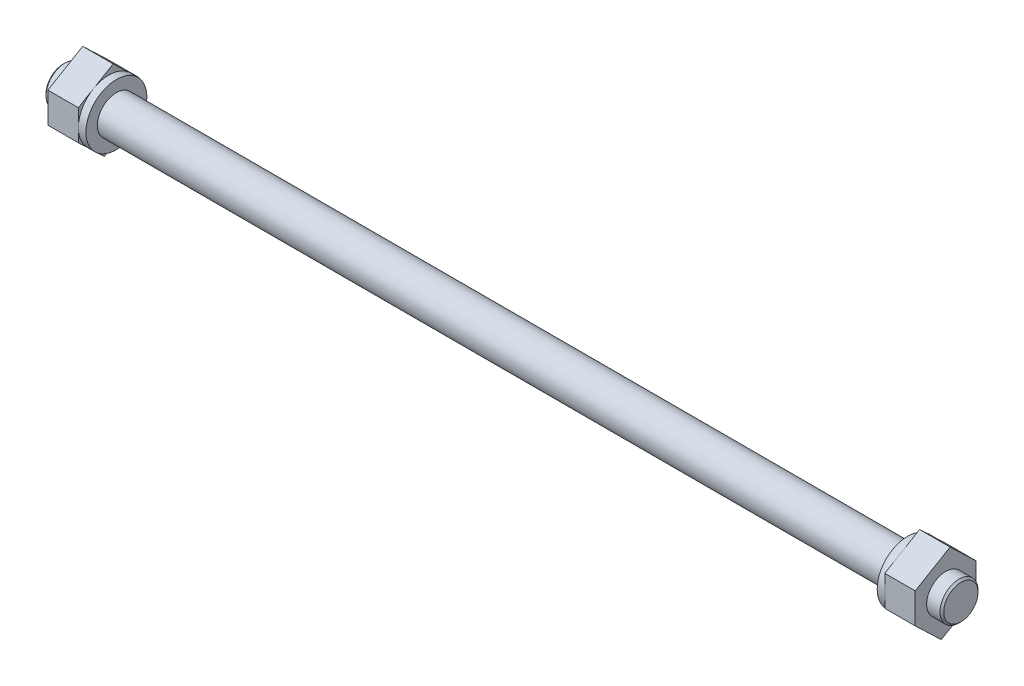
SolidWorks part; units mm, degrees
ref_plane "Plane1" through (0, 0, 0) normal (0, 0, 1) x (1, 0, 0)
ref_plane "Plane2" through (0, 0, 0) normal (0, 1, 0) x (1, 0, 0)
ref_plane "Plane3" through (0, 0, 0) normal (1, 0, 0) x (0, 0, -1)
sketch "Esquisse1" plane through (0, 0, 0) normal (0, 0, 1) x (1, 0, 0)
  line L0 (-118, 0) -> (-118, 2.5)
  line L1 (-118, 2.5) -> (-112, 2.5)
  line L2 (-112, 2.5) -> (-112, 4)
  line L3 (-112, 4) -> (-111, 4)
  line L4 (-111, 4) -> (-111, 2.5)
  line L5 (-111, 2.5) -> (-7, 2.5)
  line L6 (-7, 2.5) -> (-7, 4)
  line L7 (-7, 4) -> (-6, 4)
  line L8 (-6, 4) -> (-6, 2.5)
  line L9 (-6, 2.5) -> (0, 2.5)
  line L10 (0, 2.5) -> (0, 0)
  line L11 (-128, 0) -> (32, 0) construction
  line L12 (-118, 0) -> (0, 0)
  dimension "D1" = 104
  dimension "D2" = 6
  dimension "D3" = 1
  dimension "D4" = 1
  dimension "D5" = 118
  dimension "D6" = 4
  dimension "D7" = 2.5
  dimension "D8" = 2.5
  dimension "D9" = 4
  dimension "D10" = 2.5
  dimension "D11" = 2.5
revolve "Base-Révolution" add sketch "Esquisse1" angle 360 about L11
sketch "Esquisse2" plane through (-6, 0, 0) normal (1, 0, 0) x (0, 0, -1)
  line L0 (0.5771, 4.9821) -> (-4, 2.2864)
  line L1 (-4, 2.2864) -> (-4, -1.7098)
  line L2 (-4, -1.7098) -> (-0.5771, -4.9821)
  line L3 (-0.5771, -4.9821) -> (4, -2.2864)
  line L4 (4, -2.2864) -> (4, 1.7098)
  line L5 (4, 1.7098) -> (0.5771, 4.9821)
  dimension "D1" = 8
  dimension "D2" = 8
  dimension "D3" = 8
  dimension "D4" = 4
  dimension "D5" = 4
  dimension "D6" = 4
extrude "Boss.-Extru.1" add sketch "Esquisse2" along normal blind 4
pattern_linear "Répétition linéaire1" count 2 spacing 110
chamfer "Chanfrein2" distance 0.25 angle 45
chamfer "Chanfrein3" distance 0.25 angle 45
